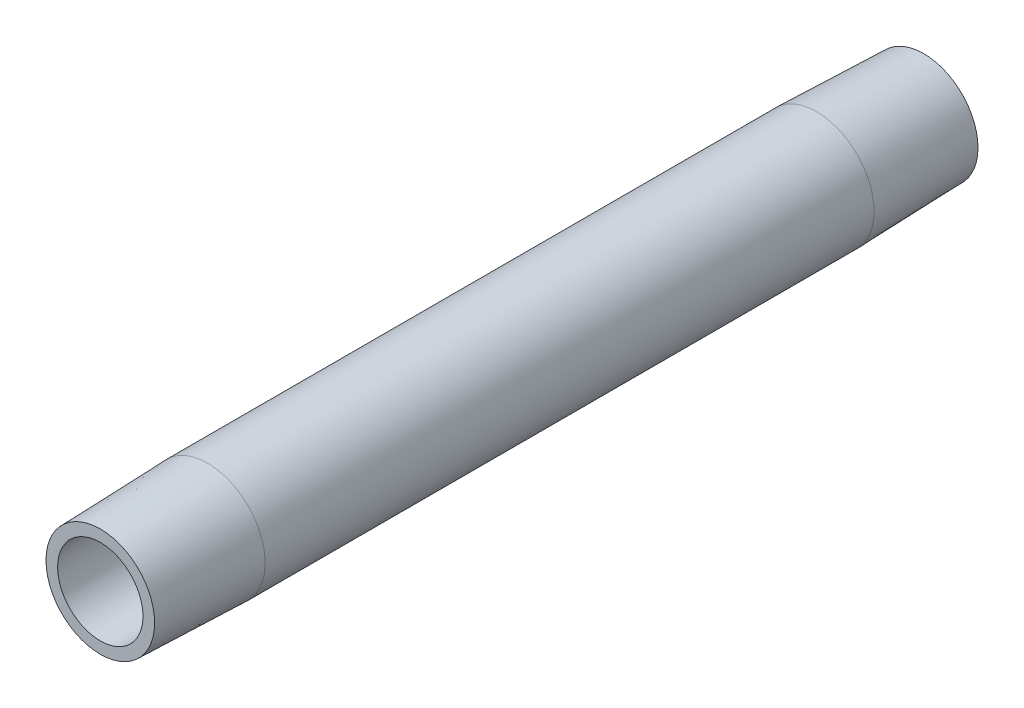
SolidWorks part; units mm, degrees
ref_plane "Front" through (0, 0, 0) normal (0, 0, 1) x (1, 0, 0)
ref_plane "Top" through (0, 0, 0) normal (0, 1, 0) x (1, 0, 0)
ref_plane "Right" through (0, 0, 0) normal (1, 0, 0) x (0, 0, -1)
sketch "PipeSketch" plane through (0, 0, 0) normal (0, 0, 1) x (1, 0, 0)
  circle A0 centre (0, 0) radius 10.668
  circle A1 centre (0, 0) radius 7.8994
  dimension "OuterDiameter" = 21.336
  dimension "InnerDiameter" = 15.7988
extrude "Extrusion" add sketch "PipeSketch" along normal blind 152.4
sketch "ThdSketch" plane through (0, 0, 0) normal (1, 0, 0) x (0, 0, -1)
  line L0 (-152.4, 0) -> (0, 0) construction
  line L1 (-152.4, 0) -> (0, 0) construction
  line L2 (-132.5499, 10.668) -> (-152.4, 10.05)
  line L3 (0, 10.668) -> (-152.4, 10.668) construction
  line L4 (-152.4, 10.668) -> (-152.4, -10.668) construction
  line L5 (-152.4, 10.05) -> (-152.4, 10.668)
  line L6 (-152.4, 10.668) -> (-132.5499, 10.668)
  line L7 (0, -10.668) -> (0, 10.668) construction
  line L8 (-76.2, 0) -> (-76.2, 9.1165) construction
  line L9 (0, 10.668) -> (-19.8501, 10.668)
  line L10 (0, 10.05) -> (0, 10.668)
  line L11 (-19.8501, 10.668) -> (0, 10.05)
  dimension "L4" = 19.8501
  dimension "D2" = 1.783
revolve "Thread" cut sketch "ThdSketch" angle 360 about L0
sketch "FilterSketch" plane through (0, 0, 0) normal (0, 0, 1) x (1, 0, 0)
  circle A0 centre (0, 0) radius 6.35
  dimension "NominalDiameter" = 12.7
